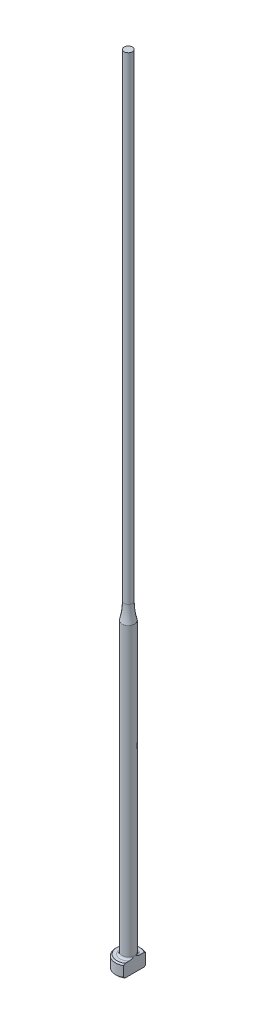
SolidWorks part; units mm, degrees
ref_plane "Front Plane" through (0, 0, 0) normal (0, 0, 1) x (1, 0, 0)
ref_plane "Top Plane" through (0, 0, 0) normal (0, 1, 0) x (1, 0, 0)
ref_plane "Right Plane" through (0, 0, 0) normal (1, 0, 0) x (0, 0, -1)
sketch "Sketch1" plane through (0, 0, 0) normal (0, 0, 1) x (1, 0, 0)
  line L0 (0, 259.9588) -> (0, -15.1925) construction
  line L1 (0, 0) -> (-2, 0)
  line L2 (-2, 0) -> (-2, 2)
  line L3 (-2, 2) -> (-1, 2)
  line L4 (-0.65, 50) -> (-0.65, 125)
  line L5 (-0.65, 125) -> (0, 125)
  line L6 (0, 125) -> (0, 0)
  line L7 (-1, 2) -> (-1, 47.3775)
  arc A0 (-1, 47.3775) -> (-0.65, 50) centre (-10.65, 50) ccw
  point P13 (-1, 0)
  dimension "D1" = 10
  dimension "L" = 125
  dimension "H" = 4
  dimension "T" = 2
  dimension "D" = 1.3
  dimension "B" = 2
  dimension "S" = 50
revolve "Revolve1" add sketch "Sketch1" angle 360 about L0
chamfer "Chamfer1" distance 0.2 angle 45 2 edges at (0, 2, 2) (0, 0, 2)
fillet "Fillet1" radius 0.3 1 edges at (0, 2, 1)
sketch "Sketch2" plane through (0, 0, 0) normal (0, 1, 0) x (1, 0, 0)
  line L0 (1, 1.7321) -> (1, -1.7321)
  circle A0 centre (0, 0) radius 2 construction
  arc A1 (1, -1.7321) -> (1, 1.7321) centre (0, 0) ccw
  circle A2 centre (0, 0) radius 1 construction
extrude "KEY" cut sketch "Sketch2" along normal through all
